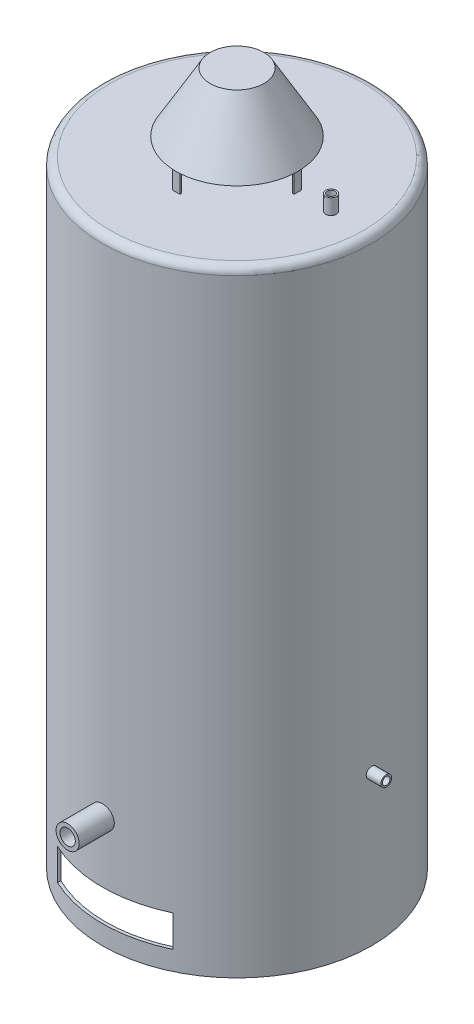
SolidWorks part; units mm, degrees
ref_plane "Front Plane" through (0, 0, 0) normal (0, 0, 1) x (1, 0, 0)
ref_plane "Top Plane" through (0, 0, 0) normal (0, 1, 0) x (1, 0, 0)
ref_plane "Right Plane" through (0, 0, 0) normal (1, 0, 0) x (0, 0, -1)
sketch "Sketch1" plane through (0, 0, 0) normal (0, 0, 1) x (1, 0, 0)
  line L0 (-23.8776, 578.4748) -> (-23.8776, -321.5252) construction
  line L1 (11.1224, 478.4748) -> (11.1224, -230.466)
  line L2 (11.1224, 478.4748) -> (151.1224, 478.4748)
  line L3 (151.1224, 478.4748) -> (151.1224, -321.4286)
  line L4 (11.1224, 578.4748) -> (55.381, 501.8166)
  line L5 (11.1224, -230.466) -> (147.1224, -230.466)
  line L6 (15.1224, 474.4748) -> (147.1224, 474.4748)
  line L7 (15.1224, 474.4748) -> (15.1224, -226.466)
  line L8 (15.1224, -226.466) -> (147.1224, -226.466)
  line L9 (147.1224, 474.4748) -> (147.1224, -226.466)
  line L10 (147.1224, -230.466) -> (147.1224, -321.4286)
  line L11 (147.1224, -321.4286) -> (151.1224, -321.4286)
  line L12 (11.1224, 478.4748) -> (15.1224, 478.4748)
  line L13 (11.1224, 478.4748) -> (11.1224, 498.4748)
  line L14 (11.1224, 498.4748) -> (15.1224, 498.4748)
  line L15 (15.1224, 478.4748) -> (15.1224, 498.4748)
  line L16 (-23.8776, 578.4748) -> (11.1224, 578.4748)
  line L17 (-23.8776, 578.4748) -> (-23.8776, 574.4748)
  line L18 (-23.8776, 574.4748) -> (11.1224, 574.4748)
  line L19 (11.1224, 578.4748) -> (11.1224, 574.4748)
  line L20 (53.0716, 501.8166) -> (11.1224, 574.4748)
  line L21 (53.0716, 501.8166) -> (55.381, 501.8166)
  line L22 (53.0716, 501.8166) -> (53.0716, 478.4748)
  line L23 (55.381, 501.8166) -> (55.381, 478.4748)
  dimension "D1" = 900
  dimension "D2" = 175
  dimension "D3" = 800
  dimension "D4" = 4
  dimension "D5" = 4
  dimension "D6" = 4
  dimension "D7" = 35
  dimension "D8" = 20
  dimension "D9" = 4
  dimension "D10" = 30
revolve "Revolve2" add sketch "Sketch1" angle 360 about L0
sketch "Sketch2" plane through (0, 0, 0) normal (0, 0, 1) x (1, 0, 0)
  line L0 (-23.8776, 501.8166) -> (-23.8776, 478.4748) construction
  line L1 (-103.1361, 501.8166) -> (55.381, 501.8166) construction
  line L2 (151.1224, 478.4748) -> (-198.8776, 478.4748) construction
  line L3 (-18.8776, 501.8166) -> (-18.8776, 478.4748)
  line L4 (-18.8776, 501.8166) -> (-28.8776, 501.8166)
  line L5 (-23.8776, 501.8166) -> (-23.8776, 478.4748)
  line L6 (-18.8776, 478.4748) -> (-28.8776, 478.4748)
  line L7 (-28.8776, 501.8166) -> (-28.8776, 478.4748)
  line L8 (-28.8776, 501.8166) -> (-78.8776, 501.8166)
  line L9 (-28.8776, 501.8166) -> (-28.8776, 478.4748)
  line L10 (-28.8776, 478.4748) -> (-78.8776, 478.4748)
  line L11 (-78.8776, 501.8166) -> (-78.8776, 478.4748)
  line L12 (-18.8776, 478.4748) -> (31.1224, 478.4748)
  line L13 (-18.8776, 501.8166) -> (31.1224, 501.8166)
  line L14 (31.1224, 501.8166) -> (31.1224, 478.4748)
  dimension "D1" = 5
  dimension "D2" = 50
extrude "Cut-Extrude1" cut sketch "Sketch2" against normal through all both and the other way through all contours L8 L11 L10 L7 | L14 L13 L3 L12
sketch "Sketch3" plane through (0, 0, 0) normal (1, 0, 0) x (0, 0, -1)
  line L0 (0, 501.8166) -> (0, 478.4748) construction
  line L1 (-57.0695, 501.8166) -> (57.0695, 501.8166) construction
  line L2 (175, 478.4748) -> (-175, 478.4748) construction
  line L3 (57.0695, 478.4748) -> (-57.0695, 478.4748) construction
  line L4 (5, 501.8166) -> (-5, 501.8166)
  line L5 (0, 501.8166) -> (0, 478.4748)
  line L6 (5, 478.4748) -> (-5, 478.4748)
  line L7 (-5, 501.8166) -> (-5, 478.4748)
  line L8 (5, 478.4748) -> (66.2268, 478.4748)
  line L9 (-5, 501.8166) -> (-66.2268, 501.8166)
  line L10 (-5, 501.8166) -> (-5, 478.4748)
  line L11 (-5, 478.4748) -> (-66.2268, 478.4748)
  line L12 (-66.2268, 501.8166) -> (-66.2268, 478.4748)
  line L13 (5, 501.8166) -> (5, 478.4748)
  line L14 (5, 501.8166) -> (66.2268, 501.8166)
  line L15 (66.2268, 501.8166) -> (66.2268, 478.4748)
  dimension "D1" = 5
extrude "Cut-Extrude2" cut sketch "Sketch3" against normal through all both and the other way through all contours L9 L12 L11 L7 | L15 L14 L13 L8
sketch "Sketch4" plane through (0, 478.4748, 0) normal (0, 1, 0) x (1, 0, 0)
  circle A0 centre (-23.8776, 0) radius 35
  circle A1 centre (-23.8776, 0) radius 39
extrude "Boss-Extrude1" add sketch "Sketch4" along normal blind 20
fillet "Fillet3" radius 10 1 edges at (-198.8776, 478.4748, 0)
fillet "Fillet4" radius 10 1 edges at (-194.8776, 474.4748, 0)
sketch "Sketch5" plane through (0, 0, 0) normal (0, 0, 1) x (1, 0, 0)
  line L0 (-23.8776, -321.4286) -> (-23.8776, 578.4748) construction
  line L1 (-198.8776, -321.4286) -> (151.1224, -321.4286) construction
  line L2 (11.1224, 578.4748) -> (-58.8776, 578.4748) construction
  line L3 (-58.8776, -230.466) -> (11.1224, -230.466) construction
  line L4 (-98.8776, -255.466) -> (51.1224, -255.466)
  line L5 (-23.8776, -255.466) -> (-23.8776, -296.4286)
  line L6 (-98.8776, -296.4286) -> (51.1224, -296.4286)
  line L7 (51.1224, -255.466) -> (51.1224, -296.4286)
  line L8 (-194.8776, -321.4286) -> (147.1224, -321.4286) construction
  line L9 (-98.8776, -255.466) -> (-98.8776, -296.4286)
  dimension "D1" = 25
  dimension "D2" = 25
  dimension "D3" = 75
extrude "Cut-Extrude5" cut sketch "Sketch5" against normal through all both and the other way through all contours L4 L9 L6 L5 | L7 L4 L5 L6
sketch "Sketch6" plane through (0, 0, 0) normal (1, 0, 0) x (0, 0, -1)
  circle A0 centre (0, -275.9473) radius 10
extrude "Cut-Extrude6" cut sketch "Sketch6" against normal up to next
sketch "Sketch7" plane through (0, 478.4748, 0) normal (0, 1, 0) x (1, 0, 0)
  line L0 (-23.8776, 0) -> (55.381, 0) construction
  line L1 (55.381, 0) -> (141.1224, 0) construction
  arc A0 (55.2232, -5) -> (55.2232, 5) centre (-23.8776, 0) ccw construction
  circle A1 centre (-23.8776, 0) radius 165 construction
  circle A2 centre (98.2517, 0) radius 5
  circle A3 centre (98.2517, 0) radius 7
extrude "Boss-Extrude2" add sketch "Sketch7" along normal blind 20
sketch "Sketch8" plane through (0, 0, 0) normal (1, 0, 0) x (0, 0, -1)
  line L0 (0, -321.4286) -> (0, 578.4748) construction
  line L1 (-175, -321.4286) -> (175, -321.4286) construction
  line L2 (35, 578.4748) -> (-35, 578.4748) construction
  line L3 (0, 578.4748) -> (12.5467, 233.7528) construction
  line L4 (171, -226.466) -> (-171, -226.466) construction
  circle A0 centre (0, -126.466) radius 5
  circle A1 centre (0, -126.466) radius 7
  dimension "D1" = 100
extrude "Boss-Extrude3" add sketch "Sketch8" along normal blind 30 from offset 140
sketch "Sketch9" plane through (0, 0, 0) normal (0, 0, 1) x (1, 0, 0)
  line L0 (-23.8776, 578.4748) -> (-23.8776, -321.4286) construction
  line L1 (11.1224, 578.4748) -> (-58.8776, 578.4748) construction
  line L2 (-198.8776, -321.4286) -> (151.1224, -321.4286) construction
  line L3 (15.1224, -226.466) -> (-62.8776, -226.466) construction
  circle A0 centre (-23.8776, -176.466) radius 10
  circle A1 centre (-23.8776, -176.466) radius 15
  dimension "D1" = 50
extrude "Boss-Extrude4" add sketch "Sketch9" along normal blind 80 from offset 140
sketch "Sketch10" plane through (0, 478.4748, 0) normal (0, 1, 0) x (1, 0, 0)
  circle A0 centre (98.2517, 0) radius 5
extrude "Cut-Extrude8" cut sketch "Sketch10" against normal up to next
sketch "Sketch11" plane through (0, 0, 0) normal (1, 0, 0) x (0, 0, -1)
  circle A0 centre (0, -126.466) radius 5
extrude "Cut-Extrude10" cut sketch "Sketch11" along normal through all from offset 110
sketch "Sketch12" plane through (0, 0, 0) normal (0, 0, 1) x (1, 0, 0)
  circle A0 centre (-23.8776, -176.466) radius 10
extrude "Cut-Extrude11" cut sketch "Sketch12" along normal through all from offset 120
